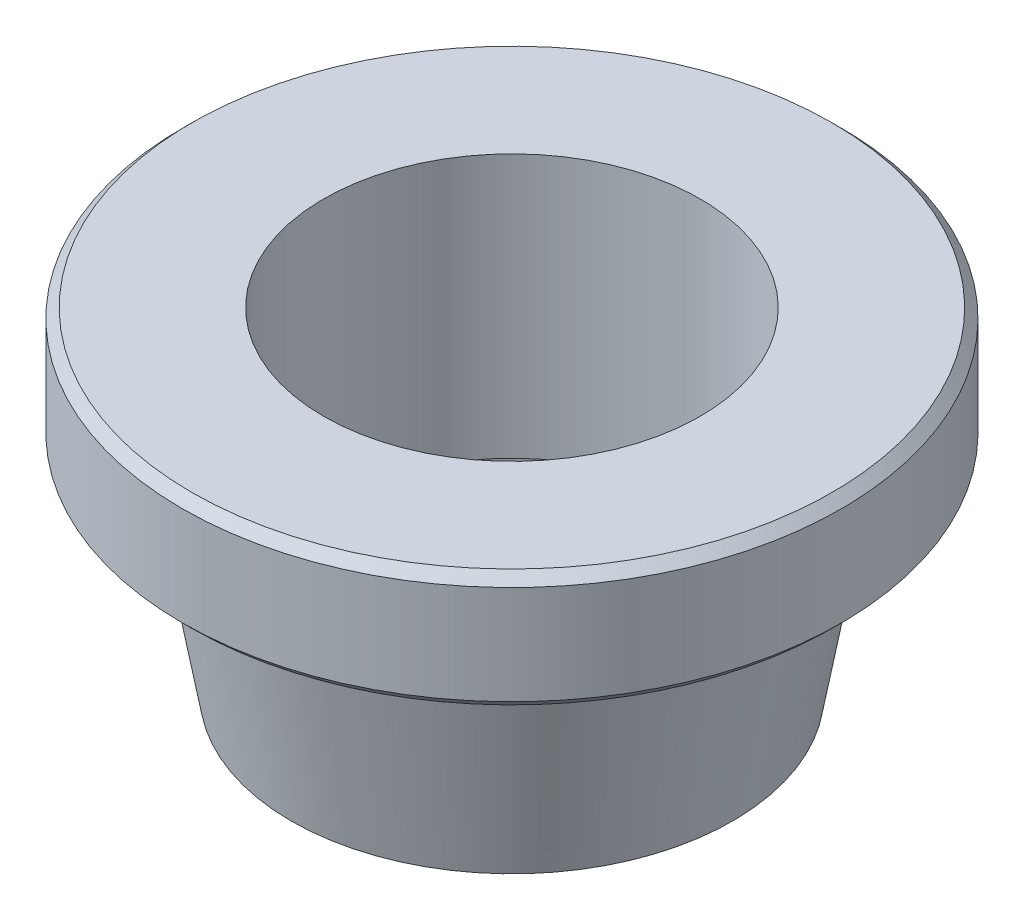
SolidWorks part; units mm, degrees
ref_plane "Přední rovina" through (0, 0, 0) normal (0, 0, 1) x (1, 0, 0)
ref_plane "Horní rovina" through (0, 0, 0) normal (0, 1, 0) x (1, 0, 0)
ref_plane "Pravá rovina" through (0, 0, 0) normal (1, 0, 0) x (0, 0, -1)
sketch "Skica1" plane through (0, 0, 0) normal (0, 1, 0) x (1, 0, 0)
  circle A0 centre (0, 0) radius 5.5
extrude "Přidat vysunutím1" add sketch "Skica1" against normal blind 4.6 draft 10
sketch "Skica2" plane through (0, 0, 0) normal (0, 1, 0) x (-1, 0, 0)
  circle A0 centre (0, 0) radius 7
extrude "Přidat vysunutím2" add sketch "Skica2" along normal blind 2.5
chamfer "Zkosení1" distance 0.2 angle 45 2 edges at (0, 0, 7) (0, 2.5, 7)
sketch "Skica3" plane through (0, 2.5, 0) normal (0, 1, 0) x (1, 0, 0)
  circle A0 centre (0, 0) radius 4
extrude "Odebrat vysunutím1" cut sketch "Skica3" against normal blind 2.5
sketch "Skica4" plane through (0, -4.6, 0) normal (0, -1, 0) x (1, 0, 0)
  circle A0 centre (0, 0) radius 4
extrude "Odebrat vysunutím2" cut sketch "Skica4" against normal up to surface (4.6 mm away)
sketch "Skica5" plane through (0, 0, 0) normal (0, 0, 1) x (1, 0, 0)
  line L0 (-4.6889, -4.6) -> (4.6889, -4.6) construction
  line L1 (-4.3, -3.6) -> (-4, -3.6)
  line L2 (-4.3, -3.6) -> (-4.3, -3.1)
  line L3 (-4.3, -3.1) -> (-4, -3.1)
  line L4 (-4, -3.6) -> (-4, -3.1)
  line L5 (-4, -4.6) -> (4, -4.6) construction
  point P8 (-3.25, -4.6)
  dimension "D1" = 0.3
  dimension "D2" = 0.5
  dimension "D3" = 1
  dimension "D5" = 4.3
ref_axis "Osa1" through (0, 2.5, 0) along (0, -1, 0)
revolve "Odebrat rotací1" cut sketch "Skica5" angle 360 about axis through (0, 2.5, 0) along (0, -1, 0)
